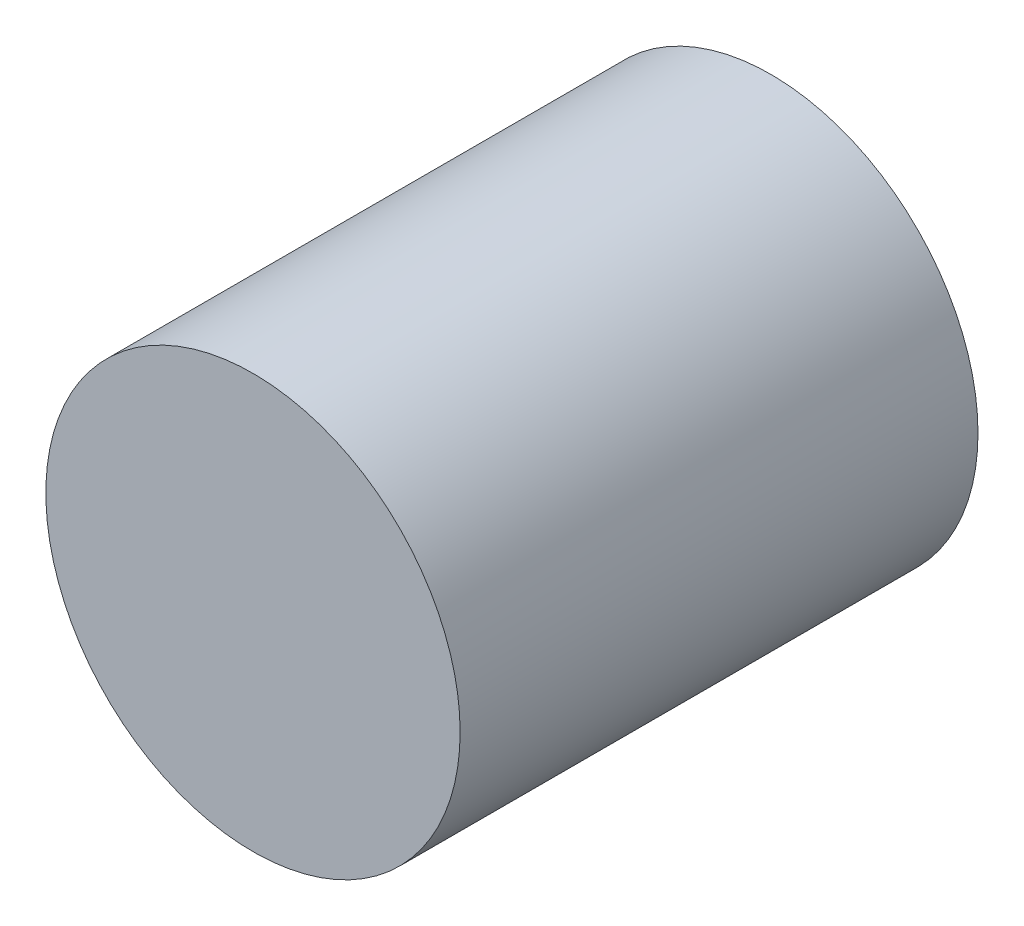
SolidWorks part; units mm, degrees
ref_plane "Ebene vorne" through (0, 0, 0) normal (0, 0, 1) x (1, 0, 0)
ref_plane "Ebene oben" through (0, 0, 0) normal (0, 1, 0) x (1, 0, 0)
ref_plane "Ebene rechts" through (0, 0, 0) normal (1, 0, 0) x (0, 0, -1)
sketch "Skizze1" plane through (0, 0, 0) normal (0, 0, 1) x (1, 0, 0)
  circle A0 centre (0, 0) radius 10
  dimension "D1" = 20
extrude "Aufsatz-Linear austragen1" add sketch "Skizze1" along normal blind 25
